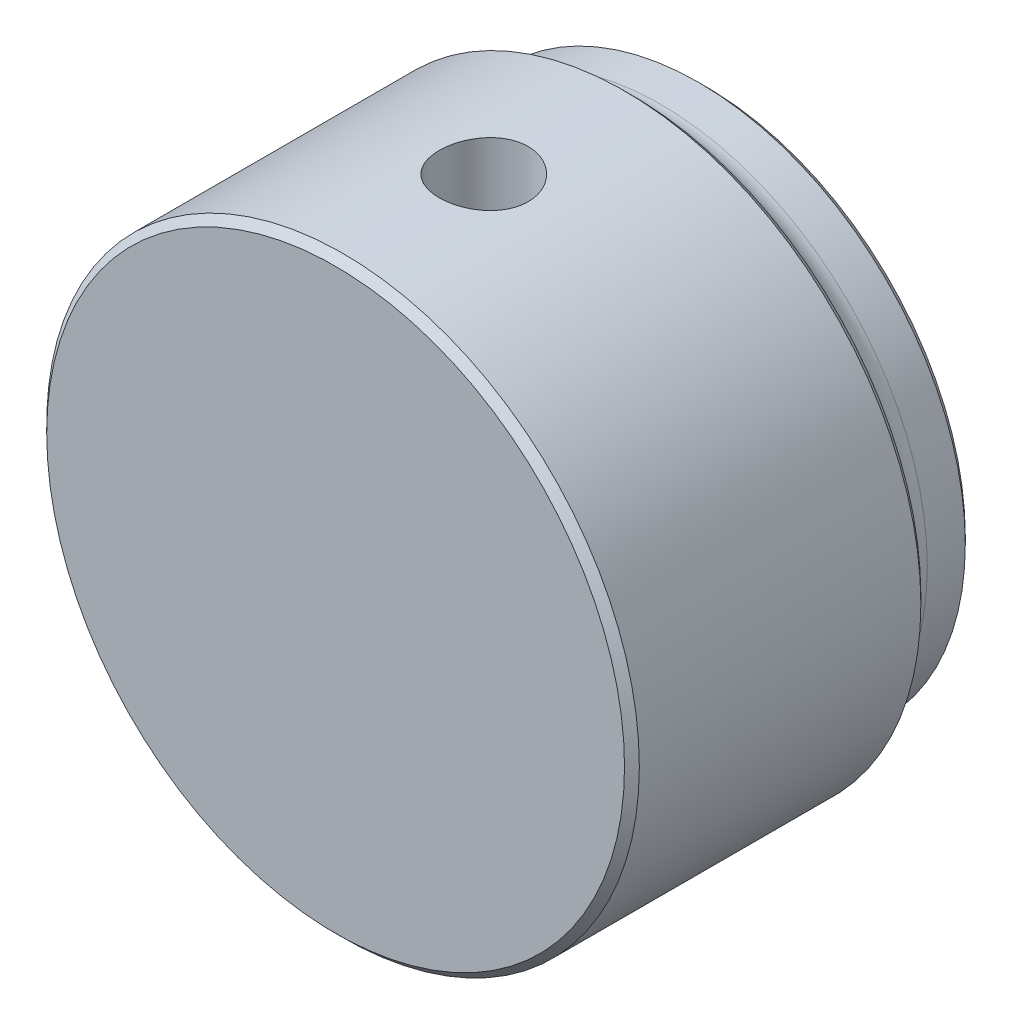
SolidWorks part; units mm, degrees
ref_plane "Front Plane" through (0, 0, 0) normal (0, 0, 1) x (1, 0, 0)
ref_plane "Top Plane" through (0, 0, 0) normal (0, 1, 0) x (1, 0, 0)
ref_plane "Right Plane" through (0, 0, 0) normal (1, 0, 0) x (0, 0, -1)
sketch "Sketch1" plane through (0, 0, 0) normal (0, 0, 1) x (1, 0, 0)
  circle A0 centre (0, 0) radius 50.8
  dimension "D1" = 101.6
extrude "Base-Extrude" add sketch "Sketch1" along normal blind 50.8
sketch "Sketch2" plane through (0, 0, 0) normal (0, 0, -1) x (-1, 0, 0)
  circle A0 centre (0, 0) radius 45.72
  dimension "D1" = 91.44
extrude "Boss-Extrude1" add sketch "Sketch2" along normal blind 12.7
shell "Shell1" thickness 15.24
chamfer "Chamfer1" distance 1.27 angle 45
chamfer "Chamfer2" distance 1.27 angle 45
fillet "Fillet1" radius 5.08
sketch "Sketch3" plane through (0, 0, 0) normal (0, 1, 0) x (1, 0, 0)
  line L0 (0, -49.53) -> (0, -1.27) construction
  line L1 (-49.53, -50.8) -> (49.53, -50.8) construction
  circle A0 centre (0, -25.4) radius 7.62
  dimension "D1" = 15.24
  dimension "D2" = 25.4
extrude "Cut-Extrude1" cut sketch "Sketch3" against normal through all and the other way through all
